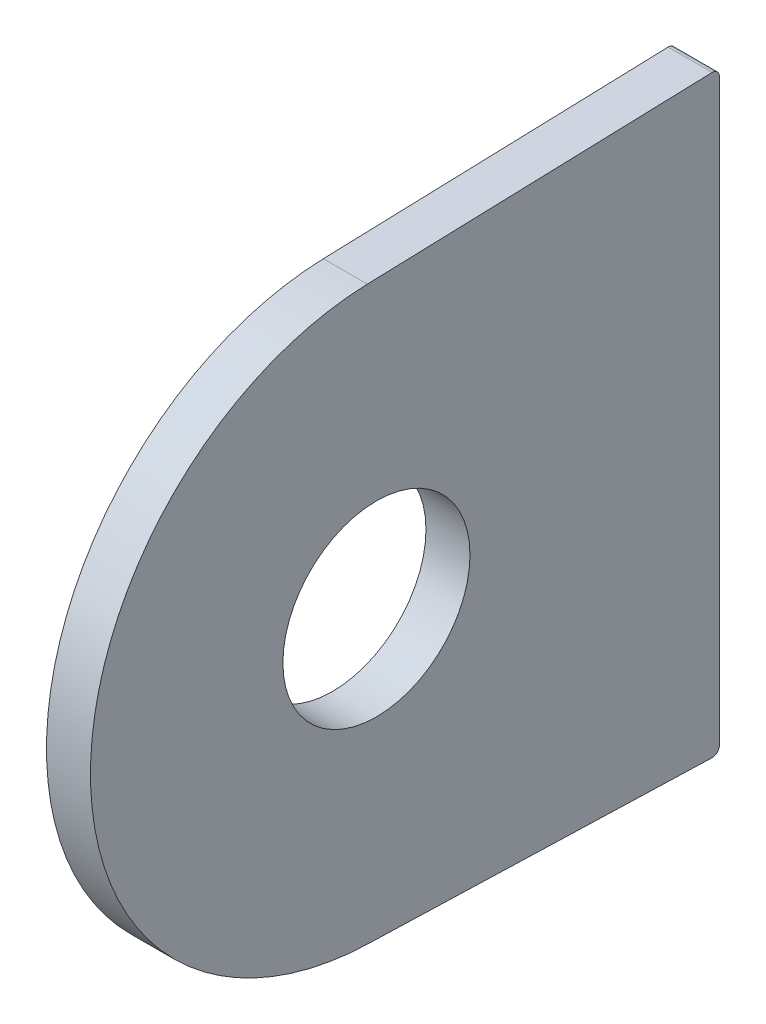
SolidWorks part; units mm, degrees
ref_plane "X-Y Datum" through (0, 0, 0) normal (0, 0, 1) x (1, 0, 0)
ref_plane "X-Z Datum" through (0, 0, 0) normal (0, 1, 0) x (1, 0, 0)
ref_plane "Y-Z Datum" through (0, 0, 0) normal (1, 0, 0) x (0, 0, -1)
sketch "Sketch1" plane through (0, 0, 0) normal (1, 0, 0) x (0, 0, -1)
  line L0 (24.747, -21.4312) -> (-0.653, -20.6272)
  line L1 (24.747, 21.4312) -> (-0.653, 20.6272)
  line L2 (24.747, -21.4312) -> (24.747, 21.4312)
  line L3 (6.75, 0) -> (24.747, 0) construction
  arc A0 (-0.653, 20.6272) -> (-0.653, -20.6272) centre (0, 0) ccw
  circle A1 centre (0, 0) radius 6.75
  dimension "D1" = 41.275
  dimension "D2" = 13.5
  dimension "D3" = 42.8625
  dimension "D5" = 13.8875
  dimension "D4" = 25.4
extrude "Boss-Extrude1" add sketch "Sketch1" along normal mid plane 3.175 contours A1 | L0 L2 L1 A0 A1
fillet "Fillet1" radius 0.508 1 edges at (0, -21.4313, -24.747)
fillet "Fillet2" radius 0.508 1 edges at (0, 21.4313, -24.747)
hole_wizard "M12 Clearance Hole1" positions "Sketch4" profile "Sketch5" hole size "M12" standard "ANSI Metric"
sketch "Sketch4" plane through (-1.5875, 0, 0) normal (-1, 0, 0) x (0, 0, 1)
  point P0 (0, 0)
sketch "Sketch5" plane through (-1.5875, 0, 0) normal (0, 1, 0) x (0, 0, 1)
  line L0 (0, 0) -> (0, 3.175)
  line L1 (0, 3.175) -> (6.75, 3.175)
  line L2 (6.75, 3.175) -> (6.75, 0)
  line L5 (6.75, 0) -> (0, 0)
  line L11 (0, -6.35) -> (0, 107.95) construction
  dimension "Thru Hole Dia." = 13.5
  dimension "Thru Hole Depth" = 3.175
